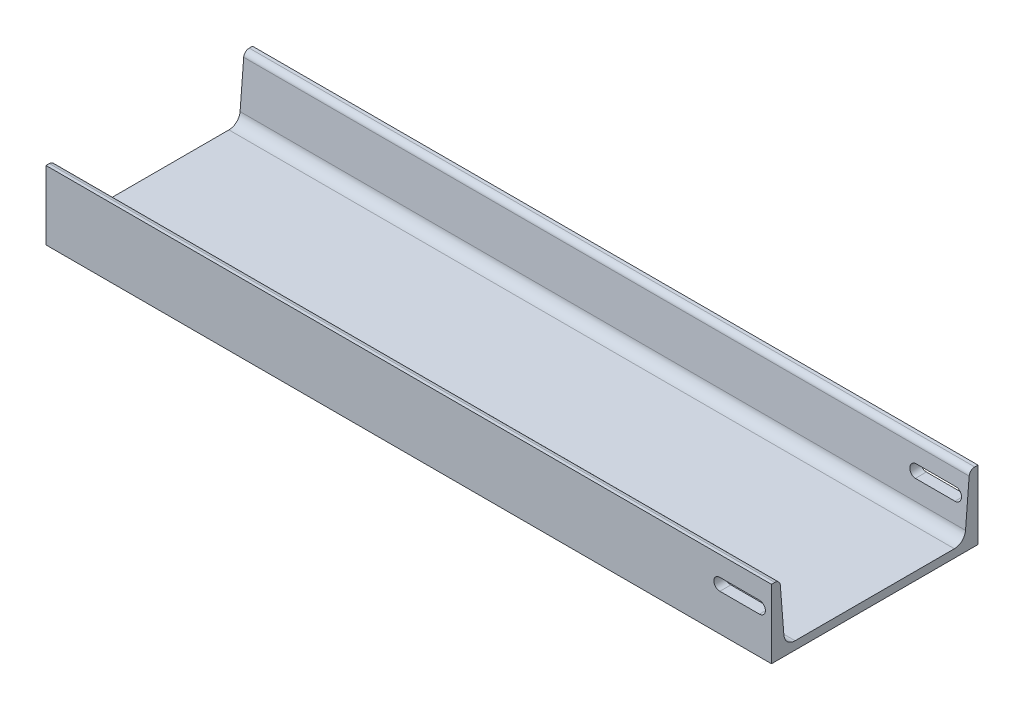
SolidWorks part; units mm, degrees
ref_plane "Plan1" through (0, 0, 0) normal (0, 0, 1) x (1, 0, 0)
ref_plane "Plan2" through (0, 0, 0) normal (0, 1, 0) x (1, 0, 0)
ref_plane "Plan3" through (0, 0, 0) normal (1, 0, 0) x (0, 0, -1)
sketch "Esquisse1" plane through (0, 0, 0) normal (1, 0, 0) x (0, 0, -1)
  line L0 (0, 0) -> (0, 80) construction
  line L1 (-120, 0) -> (120, 0)
  line L2 (120, 0) -> (120, 80)
  line L3 (120, 80) -> (116.1984, 80)
  line L4 (109.7191, 74.0179) -> (105.5184, 21.4642)
  line L5 (92.5597, 9.5) -> (-92.5597, 9.5)
  line L6 (-109.7191, 74.0179) -> (-105.5184, 21.4642)
  line L7 (-120, 80) -> (-116.1984, 80)
  line L8 (-120, 0) -> (-120, 80)
  line L10 (120, 40) -> (107, 40) construction
  arc A0 (105.5184, 21.4642) -> (92.5597, 9.5) centre (92.5597, 22.5) cw
  arc A1 (116.1984, 80) -> (109.7191, 74.0179) centre (116.1984, 73.5) ccw
  arc A2 (-116.1984, 80) -> (-109.7191, 74.0179) centre (-116.1984, 73.5) cw
  arc A3 (-105.5184, 21.4642) -> (-92.5597, 9.5) centre (-92.5597, 22.5) ccw
  point P18 (0, 9.5)
  dimension "R" = 13
  dimension "r1" = 6.5
  dimension "A" = 9.5
  dimension "D3" = 4.57
  dimension "B" = 80
  dimension "H" = 240
  dimension "A1" = 13
extrude "Base-Extrusion" add sketch "Esquisse1" along normal blind 843
sketch "Esquisse2" plane through (0, 0, 120) normal (0, 0, 1) x (1, 0, 0)
  line L0 (783, 43) -> (829, 43)
  line L1 (783, 57) -> (829, 57)
  line L2 (843, 80) -> (843, 0) construction
  line L3 (843, 80) -> (0, 80) construction
  arc A0 (829, 43) -> (829, 57) centre (829, 50) ccw
  arc A1 (783, 57) -> (783, 43) centre (783, 50) ccw
  dimension "D1" = 60
  dimension "D2" = 14
  dimension "D4" = 46
  dimension "D3" = 30
extrude "Enlèv. mat.-Extru.1" cut sketch "Esquisse2" against normal through all
